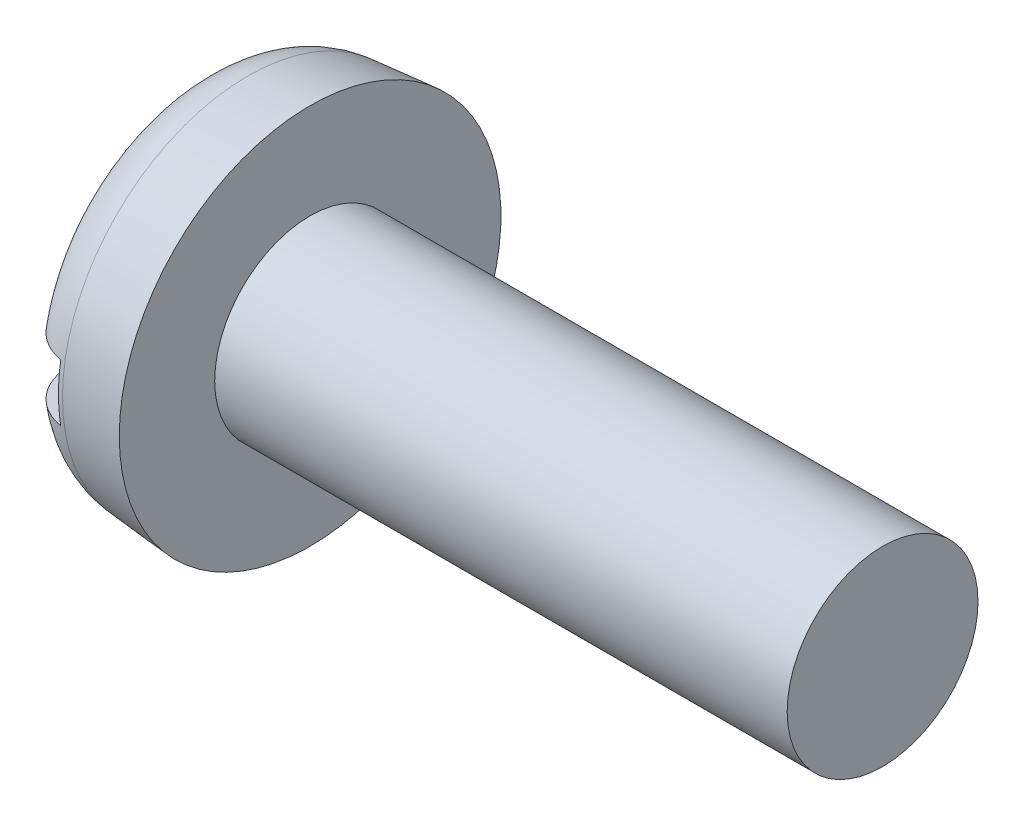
SolidWorks part; units mm, degrees
ref_plane "Plane1" through (0, 0, 0) normal (0, 0, 1) x (1, 0, 0)
ref_plane "Plane2" through (0, 0, 0) normal (0, 1, 0) x (1, 0, 0)
ref_plane "Plane3" through (0, 0, 0) normal (1, 0, 0) x (0, 0, -1)
sketch "BodySke" plane through (0, 0, 0) normal (0, 0, 1) x (1, 0, 0)
  line L0 (2.4, 2) -> (2.4, 4)
  line L1 (0, 0) -> (0, 3.79)
  line L2 (-25.4, 0) -> (127, 0) construction
  line L3 (14.4, 0) -> (0, 0)
  line L4 (2.4, 2) -> (14.4, 2)
  line L5 (14.4, 2) -> (14.4, 0)
  line L6 (0, 3.79) -> (2.4, 4)
  line L9 (3.1, 3.5875) -> (3.1, -5.9375) construction
  line L10 (2.4, 6.35) -> (2.4, -3.175) construction
  dimension "Head_ht" = 2.4
  dimension "Diameter" = 4
  dimension "Length" = 12
  dimension "Head_dia" = 8
  dimension "Advance" = 0.7
  dimension "Thread_nom" = 12
  dimension "Head_side_angle" = 5
revolve "Base-Revolve" add sketch "BodySke"
fillet "Fillet1" [suppressed] radius 0.2
fillet "Fillet2" radius 1.2 1 edges at (0, 0, 3.79)
sketch "Sketch2" plane through (0, 0, 0) normal (1, 0, 0) x (0, 0, -1)
  line L0 (4, -0.6) -> (-4, -0.6)
  line L1 (4, -0.6) -> (4, 0.6)
  line L2 (-4, 0.6) -> (4, 0.6)
  line L3 (-4, 0.6) -> (-4, -0.6)
  dimension "D1" = 8
  dimension "D2" = 4
  dimension "Slot_width" = 1.2
  dimension "D3" = 0.6
extrude "Slot" cut sketch "Sketch2" along normal blind 1
sketch "ThdSchSke" plane through (0, 0, 0) normal (0, 0, 1) x (1, 0, 0)
  line L0 (3.8, -1.61) -> (3.5269, -2)
  line L1 (3.8, -1.61) -> (4.0731, -2)
  line L2 (4.0731, -2) -> (4.0731, -2.5)
  line L3 (-3.175, 0) -> (5.1513, 0) construction
  line L5 (4.0731, -2.5) -> (3.5269, -2.5)
  line L6 (3.5269, -2.5) -> (3.5269, -2)
  dimension "Thread_minor" = 3.22
  dimension "Diameter" = 4
  dimension "Start" = 3.8
  dimension "SideAngle" = 55
  dimension "VeeAngle" = 70
  dimension "Overcut" = 5
revolve "ThreadSchematic" [suppressed] cut sketch "ThdSchSke" angle 360 about L3
pattern_linear "ThdSchPat" [suppressed]
equation "\"D1@Sketch2\" = \"Head_dia@BodySke\""
equation "\"D2@Sketch2\" = \"D1@Sketch2\" / 2"
equation "\"D3@Sketch2\" = \"Slot_width@Sketch2\" / 2"
equation "\"Thread_length@ThreadCosmetic\" = ((sgn( (\"Length@BodySke\" - \"Advance@BodySke\" * 2.0 ) - \"Thread_nom@BodySke\" )-1)*( (\"Length@BodySke\" - \"Advance@BodySke\"  * 2.0) - \"Thread_nom@BodySke\" ))/-2+ \"Thread_"
equation "\"Thread_minor@ThdSchSke\" = \"Thread_minor@ThreadCosmetic\""
equation "\"Diameter@ThdSchSke\" = \"Diameter@BodySke\""
equation "\"Overcut@ThdSchSke\" = \"Diameter@BodySke\" * 1.25"
equation "\"Start@ThdSchSke\" = \"Head_ht@BodySke\" + \"Length@BodySke\" - \"Thread_length@ThreadCosmetic\"  '---Non-countersunk---"
equation "\"Num_threads@ThdSchPat\" = int( \"Thread_length@ThreadCosmetic\" / \"Advance@BodySke\" + 0.999 )  + 1"
equation "\"Advance@ThdSchPat\" = \"Thread_length@ThreadCosmetic\" /  (\"Num_threads@ThdSchPat\" - 1) 'relax it"
